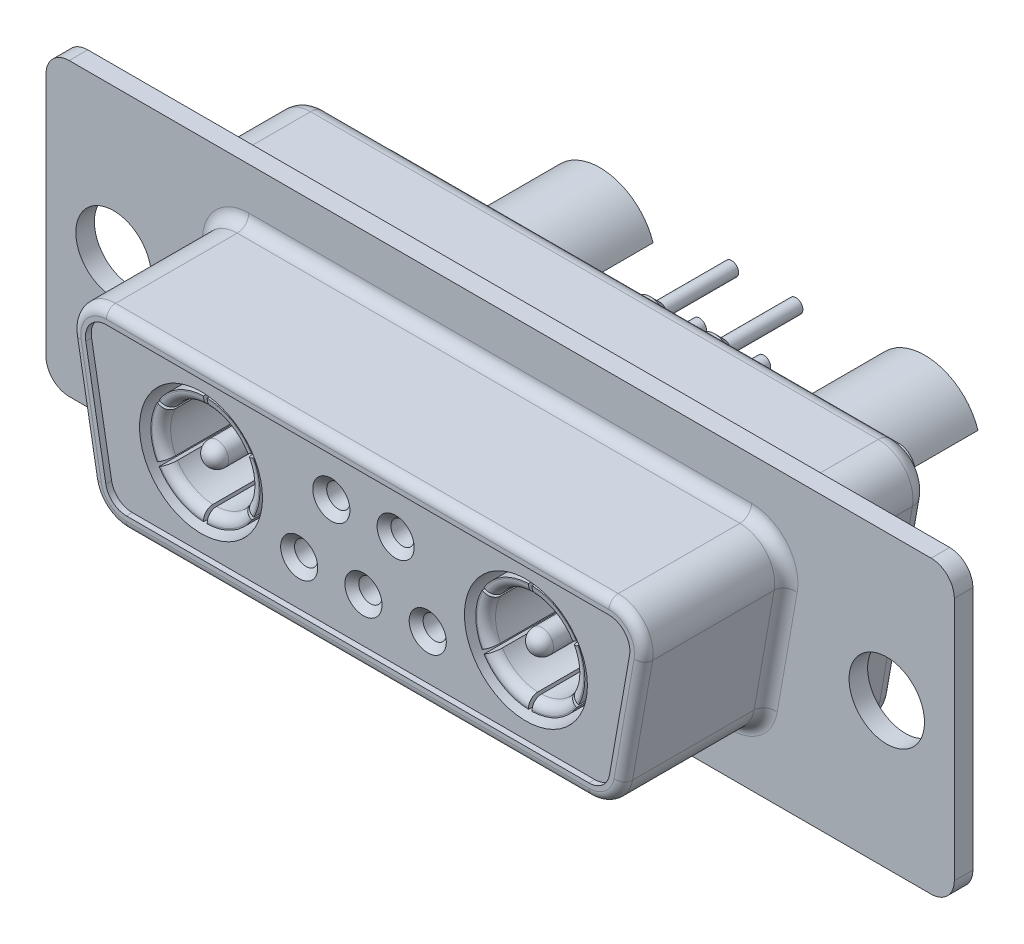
SolidWorks part; units mm, degrees
ref_plane "Plane1" through (0, 0, 0) normal (0, 0, 1) x (1, 0, 0)
ref_plane "Plane2" through (0, 0, 0) normal (0, 1, 0) x (1, 0, 0)
ref_plane "Plane3" through (0, 0, 0) normal (1, 0, 0) x (0, 0, -1)
sketch "Sketch1" plane through (0, 0, 0) normal (0, 0, 1) x (1, 0, 0)
  line L0 (-19.57, 6.27) -> (19.57, 6.27)
  line L1 (-19.57, 6.27) -> (-19.57, -6.27)
  line L2 (19.57, -6.27) -> (-19.57, -6.27)
  line L3 (19.57, -6.27) -> (19.57, 6.27)
  dimension "D1" = 39.14
  dimension "D2" = 19.57
  dimension "D3" = 12.54
  dimension "D4" = 6.27
extrude "Base-Extrude" add sketch "Sketch1" against normal blind 0.8
sketch "Sketch2" plane through (0, 0, 0) normal (0, 0, 1) x (1, 0, 0)
  line L0 (0, 9.1873) -> (0, -9.2365) construction
  line L1 (-10.83, 3.95) -> (10.83, 3.95)
  line L2 (12.3072, 2.1895) -> (11.4432, -2.7105)
  line L3 (-12.3072, 2.1895) -> (-11.4432, -2.7105)
  line L4 (9.966, -3.95) -> (-9.966, -3.95)
  line L5 (19.57, -6.27) -> (19.57, 6.27) construction
  arc A0 (10.83, 3.95) -> (12.3072, 2.1895) centre (10.83, 2.45) cw
  arc A1 (-10.83, 3.95) -> (-12.3072, 2.1895) centre (-10.83, 2.45) ccw
  arc A2 (11.4432, -2.7105) -> (9.966, -3.95) centre (9.966, -2.45) cw
  arc A3 (-11.4432, -2.7105) -> (-9.966, -3.95) centre (-9.966, -2.45) ccw
  point P6 (0, 3.95)
  point P17 (0, -3.95)
  dimension "D4" = 1.5
  dimension "D5" = 1.5
  dimension "D6" = 21.66
  dimension "D1" = 10
  dimension "D2" = 7.9
  dimension "D3" = 3.95
extrude "Boss-Extrude1" add sketch "Sketch2" along normal blind 6.14
fillet "Fillet1" radius 1 4 edges at (-19.57, 6.27, -0.4) (19.57, 6.27, -0.4) (19.57, -6.27, -0.4) (-19.57, -6.27, -0.4)
sketch "Sketch3" plane through (0, 0, 0) normal (0, 0, 1) x (1, 0, 0)
  line L0 (0, 8.696) -> (0, -7.9591) construction
  circle A0 centre (16.66, 0) radius 1.625
  circle A1 centre (-16.66, 0) radius 1.625
  dimension "D1" = 3.25
  dimension "D2" = 33.32
  dimension "D3" = 16.66
extrude "Cut-Extrude1" cut sketch "Sketch3" against normal through all
sketch "Sketch9" plane through (0, 0, -0.8) normal (0, 0, -1) x (-1, 0, 0)
  line L0 (0, 10.4156) -> (0, -10.3173) construction
  line L1 (-12.23, 5.5) -> (12.23, 5.5)
  line L2 (13.7072, 3.7395) -> (12.2966, -4.2605)
  line L3 (10.8194, -5.5) -> (-10.8194, -5.5)
  line L4 (19.57, 5.27) -> (19.57, -5.27) construction
  line L5 (-13.7072, 3.7395) -> (-12.2966, -4.2605)
  arc A0 (13.7072, 3.7395) -> (12.23, 5.5) centre (12.23, 4) ccw
  arc A1 (10.8194, -5.5) -> (12.2966, -4.2605) centre (10.8194, -4) ccw
  arc A2 (-10.8194, -5.5) -> (-12.2966, -4.2605) centre (-10.8194, -4) cw
  arc A3 (-13.7072, 3.7395) -> (-12.23, 5.5) centre (-12.23, 4) cw
  point P14 (0, -5.5)
  point P19 (0, 5.5)
  dimension "D1" = 1.5
  dimension "D2" = 11
  dimension "D4" = 12.23
  dimension "D3" = 5.5
  dimension "D5" = 10
extrude "Boss-Extrude2" add sketch "Sketch9" along normal blind 3.96
fillet "Fillet2" radius 0.4 8 edges at (11.9791, 3.4142, 6.14) (0, 3.95, 6.14) (0, -3.95, 6.14) (10.9302, -3.5991, 6.14) (11.8752, -0.2605, 6.14) (-11.9791, 3.4142, 6.14) (-11.8752, -0.2605, 6.14) (-10.9302, -3.5991, 6.14)
sketch "Sketch10" plane through (0, 0, 6.14) normal (0, 0, 1) x (1, 0, 0)
  line L4 (10.8523, -2.6063) -> (11.7163, 2.2937)
  line L5 (10.83, 3.35) -> (-10.83, 3.35)
  line L6 (-11.7163, 2.2937) -> (-10.8523, -2.6063)
  line L7 (-9.966, -3.35) -> (9.966, -3.35)
  line L8 (10.8523, -2.6063) -> (11.7163, 2.2937)
  line L9 (10.83, 3.35) -> (-10.83, 3.35)
  line L10 (-11.7163, 2.2937) -> (-10.8523, -2.6063)
  line L11 (-9.966, -3.35) -> (9.966, -3.35)
  arc A4 (9.966, -3.35) -> (10.8523, -2.6063) centre (9.966, -2.45) ccw
  arc A5 (11.7163, 2.2937) -> (10.83, 3.35) centre (10.83, 2.45) ccw
  arc A6 (-10.83, 3.35) -> (-11.7163, 2.2937) centre (-10.83, 2.45) ccw
  arc A7 (-10.8523, -2.6063) -> (-9.966, -3.35) centre (-9.966, -2.45) ccw
  arc A8 (9.966, -3.35) -> (10.8523, -2.6063) centre (9.966, -2.45) ccw
  arc A9 (11.7163, 2.2937) -> (10.83, 3.35) centre (10.83, 2.45) ccw
  arc A10 (-10.83, 3.35) -> (-11.7163, 2.2937) centre (-10.83, 2.45) ccw
  arc A11 (-10.8523, -2.6063) -> (-9.966, -3.35) centre (-9.966, -2.45) ccw
  dimension "D1" = 0.2
extrude "Cut-Extrude2" cut sketch "Sketch10" against normal blind 0.25
fillet "Fillet3" radius 0.7 8 edges at (0, 5.5, -4.76) (13.3791, 4.9642, -4.76) (11.7836, -5.1491, -4.76) (0, -5.5, -4.76) (-13.0019, -0.2605, -4.76) (-13.3791, 4.9642, -4.76) (13.0019, -0.2605, -4.76) (-11.7836, -5.1491, -4.76)
sketch "Sketch11" plane through (0, 0, -4.76) normal (0, 0, -1) x (-1, 0, 0)
  line L4 (10.4837, -3.6) -> (11.7533, 3.6)
  line L5 (11.7533, 3.6) -> (-11.7533, 3.6)
  line L6 (-11.7533, 3.6) -> (-10.4837, -3.6)
  line L7 (-10.4837, -3.6) -> (10.4837, -3.6)
  line L8 (10.4837, -3.6) -> (11.7533, 3.6)
  line L9 (11.7533, 3.6) -> (-11.7533, 3.6)
  line L10 (-11.7533, 3.6) -> (-10.4837, -3.6)
  line L11 (-10.4837, -3.6) -> (10.4837, -3.6)
  dimension "D1" = 1.2
extrude "Boss-Extrude3" add sketch "Sketch11" along normal blind 1.5
fillet "Fillet4" radius 0.7 4 edges at (10.4837, -3.6, -5.51) (-10.4837, -3.6, -5.51) (-11.7533, 3.6, -5.51) (11.7533, 3.6, -5.51)
fillet "Fillet5" radius 0.5 8 edges at (-11.9791, 3.4142, 0) (-11.8752, -0.2605, 0) (-10.9302, -3.5991, 0) (11.9791, 3.4142, 0) (11.8752, -0.2605, 0) (10.9302, -3.5991, 0) (0, -3.95, 0) (0, 3.95, 0)
fillet "Fillet6" radius 0.5 8 edges at (-13.3791, 4.9642, -0.8) (13.0019, -0.2605, -0.8) (-11.7836, -5.1491, -0.8) (-13.0019, -0.2605, -0.8) (0, -5.5, -0.8) (11.7836, -5.1491, -0.8) (13.3791, 4.9642, -0.8) (0, 5.5, -0.8)
sketch "Sketch12" plane through (0, 0, 5.89) normal (0, 0, 1) x (1, 0, 0)
  line L0 (0, 8.5487) -> (0, -8.1065) construction
  line L1 (-14.6654, 0) -> (14.1996, 0) construction
  circle A0 centre (7, 0) radius 2.65
  dimension "D1" = 5.3
  dimension "D2" = 7
extrude "Cut-Extrude3" cut sketch "Sketch12" against normal up to surface (5.89 mm away)
sketch "Sketch13" plane through (0, 0, 0) normal (0, 0, 1) x (1, 0, 0)
  circle A3 centre (7, 0) radius 2.35
  circle A4 centre (7, 0) radius 2.35
  circle A7 centre (7, 0) radius 1.9
  circle A8 centre (7, 0) radius 1.9
  dimension "D2" = 0.3
  dimension "D4" = 0.75
extrude "Boss-Extrude4" add sketch "Sketch13" along normal blind 5.7
sketch "Sketch14" plane through (0, 0, 0) normal (0, 0, 1) x (1, 0, 0)
  circle A0 centre (7, 0) radius 0.5
  dimension "D1" = 1
extrude "Boss-Extrude5" add sketch "Sketch14" along normal blind 5.7
fillet "Fillet10" radius 0.4 1 edges at (8.9, 0, 5.7)
fillet "Fillet11" radius 0.5 1 edges at (7.5, 0, 5.7)
sketch "Sketch17" plane through (0, 0, 0) normal (0, 0, 1) x (1, 0, 0)
  line L0 (7, 3.0493) -> (7, -0.3575) construction
  line L1 (6.9216, 2.45) -> (7.0784, 2.45)
  line L2 (7.0784, 2.45) -> (7.0784, 1.7406)
  line L3 (6.9216, 2.45) -> (6.9216, 1.7406)
  line L4 (7.0784, 1.7406) -> (6.9216, 1.7406)
  line L5 (5.0268, 0) -> (-5.0268, 0) construction
  point P7 (7, 2.45)
  point P10 (7, 1.7406)
  dimension "D1" = 0.0784
  dimension "D2" = 90
extrude "Cut-Extrude5" cut sketch "Sketch17" along normal through all
pattern_circular "CirPattern2" count 6 every 60 about axis through (7, 0, 0) along (0, 0, 1) of "Cut-Extrude5"
mirror "Mirror1" about plane through (0, 0, 0) normal (1, 0, 0) of "Cut-Extrude5", "Fillet11", "Fillet10", "Boss-Extrude5", "Boss-Extrude4", "Cut-Extrude3", "CirPattern2"
sketch "Sketch18" plane through (0, 0, 5.89) normal (0, 0, 1) x (1, 0, 0)
  line L0 (0, 8.4995) -> (0, -8.1556) construction
  line L1 (-10.5857, 0) -> (10.5857, 0) construction
  circle A0 centre (1.385, 1.42) radius 0.5
  circle A1 centre (-1.385, 1.42) radius 0.5
  circle A2 centre (2.77, -1.42) radius 0.5
  circle A3 centre (-2.77, -1.42) radius 0.5
  circle A5 centre (0, -1.42) radius 0.5
  dimension "D1" = 1
  dimension "D2" = 1
  dimension "D3" = 1.385
  dimension "D4" = 1.42
  dimension "D5" = 2.77
  dimension "D6" = 1.42
  dimension "D7" = 1
  dimension "D8" = 1.42
extrude "Cut-Extrude6" cut sketch "Sketch18" against normal up to surface (5.89 mm away)
chamfer "Chamfer1" distance 0.3 angle 45 5 edges at (1.885, 1.42, 5.89) (0.5, -1.42, 5.89) (-3.27, -1.42, 5.89) (3.27, -1.42, 5.89) (-1.885, 1.42, 5.89)
sketch "Sketch19" plane through (0, 0, -6.26) normal (0, 0, -1) x (-1, 0, 0)
  circle A0 centre (7, 0) radius 2.41
  dimension "D1" = 4.82
extrude "Boss-Extrude6" add sketch "Sketch19" along normal blind 5.04
sketch "Sketch20" plane through (0, 0, -6.26) normal (0, 0, -1) x (-1, 0, 0)
  circle A0 centre (7, 0) radius 1.5
  dimension "D1" = 3
extrude "Cut-Extrude7" cut sketch "Sketch20" along normal through all
sketch "Sketch21" plane through (0, 0, -11.3) normal (0, 0, -1) x (-1, 0, 0)
  line L0 (4.1027, 0.7486) -> (9.7983, 0.7486)
  line L1 (4.1027, 0.7486) -> (4.1027, -2.6063)
  line L2 (9.7983, -2.6063) -> (4.1027, -2.6063)
  line L3 (9.7983, -2.6063) -> (9.7983, 0.7486)
extrude "Cut-Extrude8" cut sketch "Sketch21" against normal blind 2.75
sketch "Sketch22" plane through (0, 0, -6.26) normal (0, 0, -1) x (-1, 0, 0)
  circle A0 centre (7, 0) radius 0.36
  dimension "D1" = 0.72
extrude "Boss-Extrude7" add sketch "Sketch22" along normal blind 4.2
mirror "Mirror3" about plane through (0, 0, 0) normal (1, 0, 0) of "Boss-Extrude7", "Cut-Extrude8", "Cut-Extrude7", "Boss-Extrude6"
sketch "Sketch23" plane through (0, 0, -6.26) normal (0, 0, -1) x (-1, 0, 0)
  circle A0 centre (1.385, 1.42) radius 0.7
  circle A1 centre (2.77, -1.42) radius 0.7
  circle A2 centre (0, -1.42) radius 0.7
  circle A3 centre (-1.385, 1.42) radius 0.7
  circle A4 centre (-2.77, -1.42) radius 0.7
  dimension "D1" = 1.4
  dimension "D2" = 1.4
  dimension "D3" = 1.4
  dimension "D4" = 1.4
  dimension "D5" = 1.4
extrude "Boss-Extrude8" add sketch "Sketch23" along normal blind 2
chamfer "Chamfer2" distance 0.4 angle 45 5 edges at (-2.085, 1.42, -8.26) (0.685, 1.42, -8.26) (-3.47, -1.42, -8.26) (-0.7, -1.42, -8.26) (2.07, -1.42, -8.26)
sketch "Sketch24" plane through (0, 0, -8.26) normal (0, 0, -1) x (-1, 0, 0)
  circle A0 centre (-1.385, 1.42) radius 0.3 construction
  circle A1 centre (1.385, 1.42) radius 0.3
  circle A2 centre (1.385, 1.42) radius 0.3
  circle A3 centre (-1.385, 1.42) radius 0.3
  circle A5 centre (2.77, -1.42) radius 0.3
  circle A6 centre (2.77, -1.42) radius 0.3
  circle A7 centre (0, -1.42) radius 0.3
  circle A8 centre (0, -1.42) radius 0.3
  circle A9 centre (-2.77, -1.42) radius 0.3
  circle A10 centre (-2.77, -1.42) radius 0.3
  dimension "D1" = 0
  dimension "D2" = 0
  dimension "D3" = 0
  dimension "D4" = 0
extrude "Boss-Extrude9" add sketch "Sketch24" along normal blind 3.1
